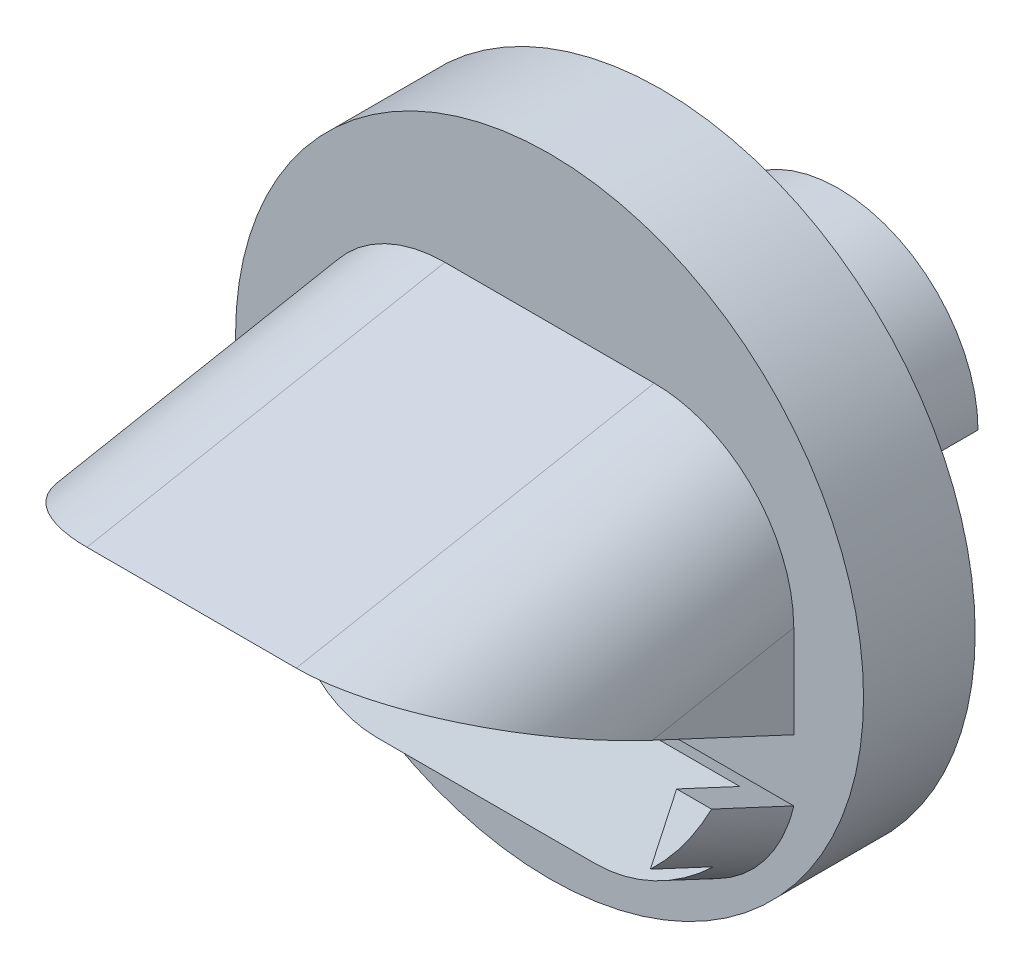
SolidWorks part; units mm, degrees
ref_plane "Front Plane" through (0, 0, 0) normal (0, 0, 1) x (1, 0, 0)
ref_plane "Top Plane" through (0, 0, 0) normal (0, 1, 0) x (1, 0, 0)
ref_plane "Right Plane" through (0, 0, 0) normal (1, 0, 0) x (0, 0, -1)
sketch "Sketch1" plane through (0, 0, 0) normal (0, 0, 1) x (1, 0, 0)
  line L0 (-173.2686, 0) -> (157.469, 0) construction
  line L1 (-10, 0) -> (-2.725, 0)
  line L2 (2.725, 0) -> (10, 0)
  arc A0 (2.725, 0) -> (-2.725, 0) centre (0, 0) ccw
  arc A1 (10, 0) -> (-10, 0) centre (0, 0) ccw
  dimension "D1" = 5.45
  dimension "D2" = 20
extrude "Boss-Extrude1" add sketch "Sketch1" along normal blind 12.7 contours A1 L1 A0 L2
sketch "Sketch2" plane through (0, 0, 0) normal (0, -1, 0) x (1, 0, 0)
  line L0 (0, 0) -> (0, 14.1186) construction
  line L1 (-10, 0) -> (-2.725, 0) construction
  circle A0 centre (-6.3625, 7) radius 2.05
  circle A1 centre (6.3625, 7) radius 2.05
  point P7 (-6.3625, 0)
  dimension "D1" = 4.1
  dimension "D2" = 7
extrude "Cut-Extrude1" cut sketch "Sketch2" against normal through all
sketch "Sketch3" plane through (0, 0, 12.7) normal (0, 0, 1) x (1, 0, 0)
  line L0 (-22.5, 0) -> (22.5, 0) construction
  arc A2 (22.5, 0) -> (-22.5, 0) centre (0, 0) ccw
  circle A3 centre (0, 0) radius 22.5
  dimension "D1" = 12.5
extrude "Boss-Extrude2" add sketch "Sketch3" along normal blind 8
sketch "Sketch4" plane through (0, 0, 0) normal (1, 0, 0) x (0, 0, -1)
  line L0 (-20.7, 12.5) -> (-19.9468, 12.1488)
  line L1 (-20.7, 22.5) -> (-20.7, -22.5) construction
  line L2 (-20.7, -17.5) -> (-65.7, 3.4838)
  line L3 (-20.7, -9.2247) -> (-53.0792, 5.874)
  line L4 (-46.3482, 7.1488) -> (-20.7, -4.8112)
  line L5 (-53.0792, 5.874) -> (-65.7, 3.4838)
  line L6 (-46.3482, 7.1488) -> (-19.9468, 12.1488)
  line L7 (-20.7, -9.2247) -> (-20.7, -17.5)
  line L8 (-19.9468, 12.1488) -> (-20.7, -4.8112)
  dimension "D5" = 7.5
  dimension "D1" = 45
  dimension "D2" = 65
  dimension "D3" = 30
  dimension "D4" = 10
  dimension "D6" = 4
  dimension "D7" = 5
extrude "Boss-Extrude3" add sketch "Sketch4" along normal mid plane 35 contours L8 L6 L4 | L3 L5 L2 L7
sketch "Sketch5" plane through (0, -22.303, 10.4) normal (0, -0.9063, 0.4226) x (1, 0, 0)
  line L0 (17.5, 61.0168) -> (-17.5, 61.0168) construction
  line L1 (-17.5, 61.0168) -> (17.5, 61.0168)
  line L2 (-17.5, 61.0168) -> (-17.5, 21.3648)
  line L3 (-17.5, 21.3648) -> (17.5, 21.3648)
  line L4 (17.5, 61.0168) -> (17.5, 21.3648)
  line L5 (-17.5, 11.3648) -> (-17.5, 61.0168) construction
  line L6 (17.5, 11.3648) -> (17.5, 61.0168) construction
  line L7 (-15, 21.3648) -> (-15, 16.3648)
  line L8 (-15, 16.3648) -> (15, 16.3648)
  line L9 (15, 16.3648) -> (15, 21.3648)
  line L10 (15, 21.3648) -> (17.5, 21.3648)
  line L11 (17.5, 11.3648) -> (-17.5, 11.3648)
  line L12 (-17.5, 11.3648) -> (-17.5, 21.3648)
  dimension "D1" = 5
  dimension "D2" = 2.5
  dimension "D3" = 2.5
  dimension "D4" = 10
extrude "Cut-Extrude2" cut sketch "Sketch5" against normal up to surface (7.5 mm away) contours L3 M7 M11 M12 | L8 L9 L3 L7
fillet "Fillet1" radius 10 2 edges at (17.5, -15.3869, 25.2315) (-17.5, -15.3869, 25.2315)
fillet "Fillet2" radius 10 2 edges at (-17.5, 9.5775, 33.5241) (17.5, 9.5775, 33.5241)
